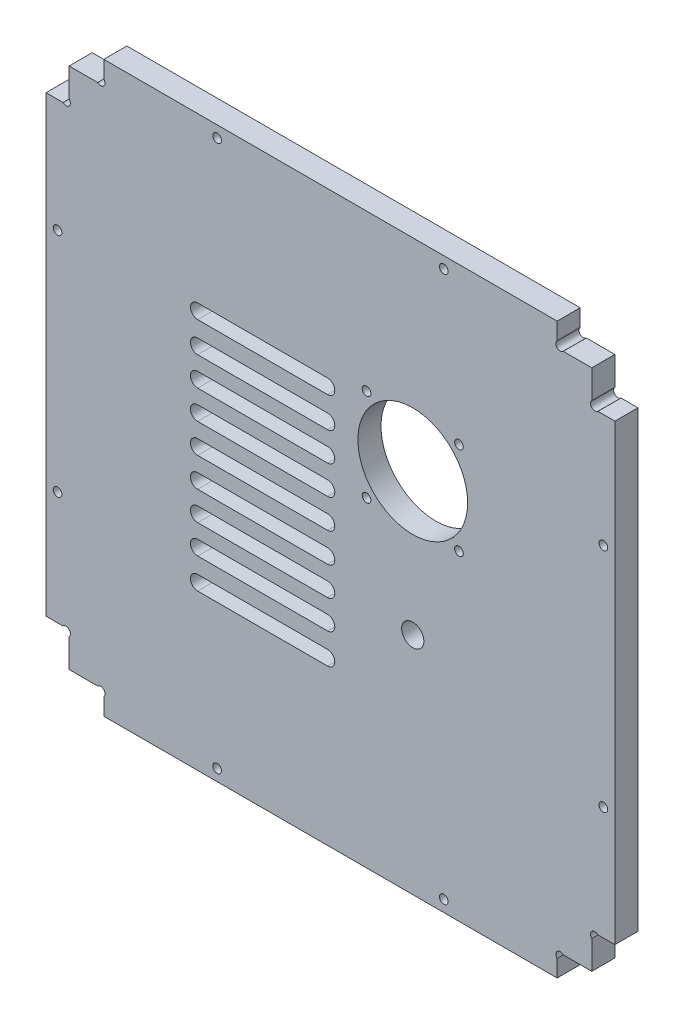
SolidWorks part; units mm, degrees
ref_plane "Plan de face" through (0, 0, 0) normal (0, 0, 1) x (1, 0, 0)
ref_plane "Plan de dessus" through (0, 0, 0) normal (0, 1, 0) x (1, 0, 0)
ref_plane "Plan de droite" through (0, 0, 0) normal (1, 0, 0) x (0, 0, -1)
sketch "Esquisse1" plane through (0, 0, 0) normal (0, 0, 1) x (1, 0, 0)
  line L0 (-279.032, 22.4842) -> (-286.103, 29.5553) construction
  line L1 (-299.032, -146.5158) -> (-293.1533, -146.5158)
  line L2 (-291.032, -148.6371) -> (-291.032, -158.5158)
  line L3 (-291.032, -158.5158) -> (-281.1533, -158.5158)
  line L4 (-102.032, 10.4842) -> (-102.032, -89.5158)
  line L5 (-200.532, 30.4842) -> (-279.032, 22.4842) construction
  line L6 (-279.032, 30.4842) -> (-279.032, 24.6055)
  line L7 (-279.032, 30.4842) -> (-122.032, 30.4842)
  line L8 (-281.1533, 22.4842) -> (-291.032, 22.4842)
  line L9 (-291.032, 22.4842) -> (-291.032, 12.6055)
  line L10 (-293.1533, 10.4842) -> (-299.032, 10.4842)
  line L11 (-279.032, -160.6371) -> (-279.032, -166.5158)
  line L12 (-102.032, -146.5158) -> (-107.9106, -146.5158)
  line L13 (-110.032, -148.6371) -> (-110.032, -158.5158)
  line L14 (-110.032, -158.5158) -> (-119.9106, -158.5158)
  line L15 (-122.032, -160.6371) -> (-122.032, -166.5158)
  line L16 (-279.032, -166.5158) -> (-122.032, -166.5158)
  line L17 (-122.032, 30.4842) -> (-122.032, 24.6055)
  line L18 (-119.9106, 22.4842) -> (-110.032, 22.4842)
  line L19 (-110.032, 22.4842) -> (-110.032, 12.6055)
  line L20 (-107.9106, 10.4842) -> (-102.032, 10.4842)
  line L21 (-291.032, 10.4842) -> (-296.8722, 16.3245) construction
  line L22 (-122.032, 22.4842) -> (-114.619, 29.8972) construction
  line L23 (-110.032, 10.4842) -> (-101.3046, 19.2116) construction
  line L24 (-110.032, -146.5158) -> (-95.7837, -160.764) construction
  line L25 (-122.032, -158.5158) -> (-110.2018, -170.3459) construction
  line L26 (-291.032, -146.5158) -> (-303.1588, -158.6426) construction
  line L27 (-279.032, -158.5158) -> (-291.9217, -171.4055) construction
  line L28 (-200.532, 30.4842) -> (-122.032, 22.4842) construction
  line L29 (-200.532, -166.5158) -> (-122.032, -158.5158) construction
  line L30 (-200.532, -166.5158) -> (-279.032, -158.5158) construction
  line L31 (-200.532, 30.4842) -> (-200.532, -166.5158) construction
  line L32 (-200.532, -68.0158) -> (-102.032, -68.0158) construction
  line L33 (-110.032, 10.4842) -> (-102.032, -68.0158) construction
  line L34 (-102.032, -68.0158) -> (-110.032, -146.5158) construction
  line L35 (-299.032, -68.0158) -> (-291.032, 10.4842) construction
  line L36 (-299.032, -68.0158) -> (-291.032, -146.5158) construction
  line L41 (-299.032, -89.5158) -> (-299.032, -146.5158)
  line L43 (-102.032, -89.5158) -> (-102.032, -146.5158)
  line L51 (-299.032, 10.4842) -> (-299.032, -89.5158)
  arc A0 (-293.1533, 10.4842) -> (-291.032, 12.6055) centre (-292.0926, 11.5449) ccw
  arc A1 (-281.1533, 22.4842) -> (-279.032, 24.6055) centre (-280.0926, 23.5449) ccw
  arc A2 (-122.032, 24.6055) -> (-119.9106, 22.4842) centre (-120.9713, 23.5449) ccw
  arc A3 (-110.032, 12.6055) -> (-107.9106, 10.4842) centre (-108.9713, 11.5449) ccw
  arc A4 (-107.9106, -146.5158) -> (-110.032, -148.6371) centre (-108.9713, -147.5764) ccw
  arc A5 (-119.9106, -158.5158) -> (-122.032, -160.6371) centre (-120.9713, -159.5764) ccw
  arc A6 (-279.032, -160.6371) -> (-281.1533, -158.5158) centre (-280.0926, -159.5764) ccw
  arc A7 (-291.032, -148.6371) -> (-293.1533, -146.5158) centre (-292.0926, -147.5764) ccw
  circle A8 centre (-295.032, -107.2658) radius 1.5
  circle A9 centre (-239.782, -162.5158) radius 1.5
  circle A10 centre (-161.282, -162.5158) radius 1.5
  circle A11 centre (-106.032, -107.2658) radius 1.5
  circle A12 centre (-106.032, -28.7658) radius 1.5
  circle A13 centre (-161.282, 26.4842) radius 1.5
  circle A14 centre (-239.782, 26.4842) radius 1.5
  circle A15 centre (-295.032, -28.7658) radius 1.5
  dimension "D7" = 20
  dimension "D15" = 8
  dimension "D16" = 20
  dimension "D4" = 45
  dimension "D11" = 8
  dimension "D2" = 45
  dimension "D3" = 45
  dimension "D5" = 45
  dimension "D6" = 45
  dimension "D8" = 45
  dimension "D9" = 45
  dimension "D10" = 45
  dimension "D12" = 8
  dimension "D14" = 8
  dimension "D17" = 20
  dimension "D18" = 8
extrude "Boss.-Extru.1" add sketch "Esquisse1" along normal blind 8
sketch "Esquisse2" plane through (0, 0, 8) normal (0, 0, 1) x (1, 0, 0)
  line L0 (-225.282, -117.7158) -> (-225.282, -19.5158) construction
  line L1 (-225.282, -19.5158) -> (-125.282, -19.5158) construction
  line L2 (-125.282, -19.5158) -> (-125.282, -117.7158) construction
  line L3 (-125.282, -117.7158) -> (-225.282, -117.7158) construction
  line L5 (-122.032, 30.4842) -> (-279.032, 30.4842) construction
  line L6 (-172.032, -59.5158) -> (-172.032, -117.7158) construction
  line L7 (-188.032, -59.5158) -> (-156.032, -59.5158) construction
  line L8 (-224.032, -125.3158) -> (-224.032, -13.7158) construction
  line L9 (-199.032, -125.3158) -> (-249.032, -125.3158) construction
  line L10 (-199.032, -13.7158) -> (-249.032, -13.7158) construction
  line L11 (-246.532, -99.6958) -> (-201.532, -99.6958) construction
  line L12 (-246.532, -97.1958) -> (-201.532, -97.1958)
  line L13 (-246.532, -102.1958) -> (-201.532, -102.1958)
  line L14 (-246.532, -89.6958) -> (-201.532, -89.6958) construction
  line L15 (-246.532, -87.1958) -> (-201.532, -87.1958)
  line L16 (-246.532, -92.1958) -> (-201.532, -92.1958)
  line L17 (-246.532, -79.6958) -> (-201.532, -79.6958) construction
  line L18 (-219.532, -79.6958) -> (-200.032, -79.6958) construction
  line L19 (-246.532, -77.1958) -> (-201.532, -77.1958)
  line L20 (-246.532, -82.1958) -> (-201.532, -82.1958)
  line L21 (-199.032, -95.1158) -> (-199.032, -89.1158) construction
  line L22 (-199.032, -102.7158) -> (-199.032, -96.7158) construction
  line L23 (-199.032, -87.5158) -> (-199.032, -51.5158) construction
  line L24 (-246.532, -110.2158) -> (-201.532, -110.2158) construction
  line L25 (-246.532, -107.7158) -> (-201.532, -107.7158)
  line L26 (-246.532, -112.7158) -> (-201.532, -112.7158)
  line L27 (-199.032, -102.7158) -> (-249.032, -102.7158) construction
  line L29 (-246.532, -69.5158) -> (-190.231, -69.5158) construction
  line L30 (-246.532, -28.8158) -> (-201.532, -28.8158) construction
  line L31 (-246.532, -31.3158) -> (-201.532, -31.3158)
  line L32 (-246.532, -26.3158) -> (-201.532, -26.3158)
  line L33 (-246.532, -59.3358) -> (-201.532, -59.3358) construction
  line L34 (-246.532, -61.8358) -> (-201.532, -61.8358)
  line L35 (-246.532, -56.8358) -> (-201.532, -56.8358)
  line L36 (-246.532, -49.3358) -> (-201.532, -49.3358) construction
  line L37 (-246.532, -51.8358) -> (-201.532, -51.8358)
  line L38 (-246.532, -46.8358) -> (-201.532, -46.8358)
  line L39 (-246.532, -39.3358) -> (-201.532, -39.3358) construction
  line L40 (-246.532, -41.8358) -> (-201.532, -41.8358)
  line L41 (-246.532, -36.8358) -> (-201.532, -36.8358)
  line L42 (-246.532, -69.5158) -> (-201.532, -69.5158) construction
  line L43 (-246.532, -67.0158) -> (-201.532, -67.0158)
  line L44 (-246.532, -72.0158) -> (-201.532, -72.0158)
  line L46 (-249.032, -87.5158) -> (-249.032, -51.5158) construction
  circle A0 centre (-172.032, -39.5158) radius 19
  circle A1 centre (-188.032, -55.5158) radius 1.5
  circle A2 centre (-156.032, -55.5158) radius 1.5
  circle A3 centre (-156.032, -23.5158) radius 1.5
  circle A4 centre (-188.032, -23.5158) radius 1.5
  circle A5 centre (-172.032, -88.6158) radius 3.85
  arc A6 (-246.532, -97.1958) -> (-246.532, -102.1958) centre (-246.532, -99.6958) ccw
  arc A7 (-201.532, -102.1958) -> (-201.532, -97.1958) centre (-201.532, -99.6958) ccw
  arc A8 (-246.532, -87.1958) -> (-246.532, -92.1958) centre (-246.532, -89.6958) ccw
  arc A9 (-201.532, -92.1958) -> (-201.532, -87.1958) centre (-201.532, -89.6958) ccw
  arc A10 (-246.532, -77.1958) -> (-246.532, -82.1958) centre (-246.532, -79.6958) ccw
  arc A11 (-201.532, -82.1958) -> (-201.532, -77.1958) centre (-201.532, -79.6958) ccw
  arc A12 (-246.532, -107.7158) -> (-246.532, -112.7158) centre (-246.532, -110.2158) ccw
  arc A13 (-201.532, -112.7158) -> (-201.532, -107.7158) centre (-201.532, -110.2158) ccw
  arc A14 (-246.532, -31.3158) -> (-246.532, -26.3158) centre (-246.532, -28.8158) cw
  arc A15 (-201.532, -26.3158) -> (-201.532, -31.3158) centre (-201.532, -28.8158) cw
  arc A16 (-246.532, -61.8358) -> (-246.532, -56.8358) centre (-246.532, -59.3358) cw
  arc A17 (-201.532, -56.8358) -> (-201.532, -61.8358) centre (-201.532, -59.3358) cw
  arc A18 (-246.532, -51.8358) -> (-246.532, -46.8358) centre (-246.532, -49.3358) cw
  arc A19 (-201.532, -46.8358) -> (-201.532, -51.8358) centre (-201.532, -49.3358) cw
  arc A20 (-246.532, -41.8358) -> (-246.532, -36.8358) centre (-246.532, -39.3358) cw
  arc A21 (-201.532, -36.8358) -> (-201.532, -41.8358) centre (-201.532, -39.3358) cw
  arc A22 (-246.532, -67.0158) -> (-246.532, -72.0158) centre (-246.532, -69.5158) ccw
  arc A23 (-201.532, -72.0158) -> (-201.532, -67.0158) centre (-201.532, -69.5158) ccw
  point P39 (-224.032, -99.6958)
  point P45 (-224.032, -89.6958)
  point P52 (-224.032, -79.6958)
  point P68 (-224.032, -110.2158)
  point P77 (-224.032, -28.8158)
  point P84 (-224.032, -59.3358)
  point P91 (-224.032, -49.3358)
  point P98 (-224.032, -39.3358)
  point P103 (-224.032, -69.5158)
  dimension "D5" = 5
  dimension "D10" = 2.5
  dimension "D11" = 2.5
  dimension "D12" = 2.5
  dimension "D13" = 45
  dimension "D4" = 2.5
  dimension "D16" = 2.5
  dimension "D2" = 100
  dimension "D3" = 50
  dimension "D6" = 5
  dimension "D7" = 5
  dimension "D8" = 5
  dimension "D9" = 5
  dimension "D14" = 5
  dimension "D15" = 5
extrude "Enlèv. mat.-Extru.1" cut sketch "Esquisse2" against normal through all
sketch "Esquisse4" plane through (0, 0, 0) normal (0, 0, -1) x (-1, 0, 0)
  line L0 (156.4203, -88.6158) -> (184.2448, -88.6158) construction
  line L1 (172.032, -75.7022) -> (172.032, -90.6263) construction
  circle A0 centre (172.032, -88.6158) radius 9 construction
  circle A1 centre (181.032, -88.6158) radius 1
  circle A2 centre (172.032, -79.6158) radius 1
  circle A3 centre (163.032, -88.6158) radius 1
extrude "Enlèv. mat.-Extru.2" cut sketch "Esquisse4" against normal blind 3
